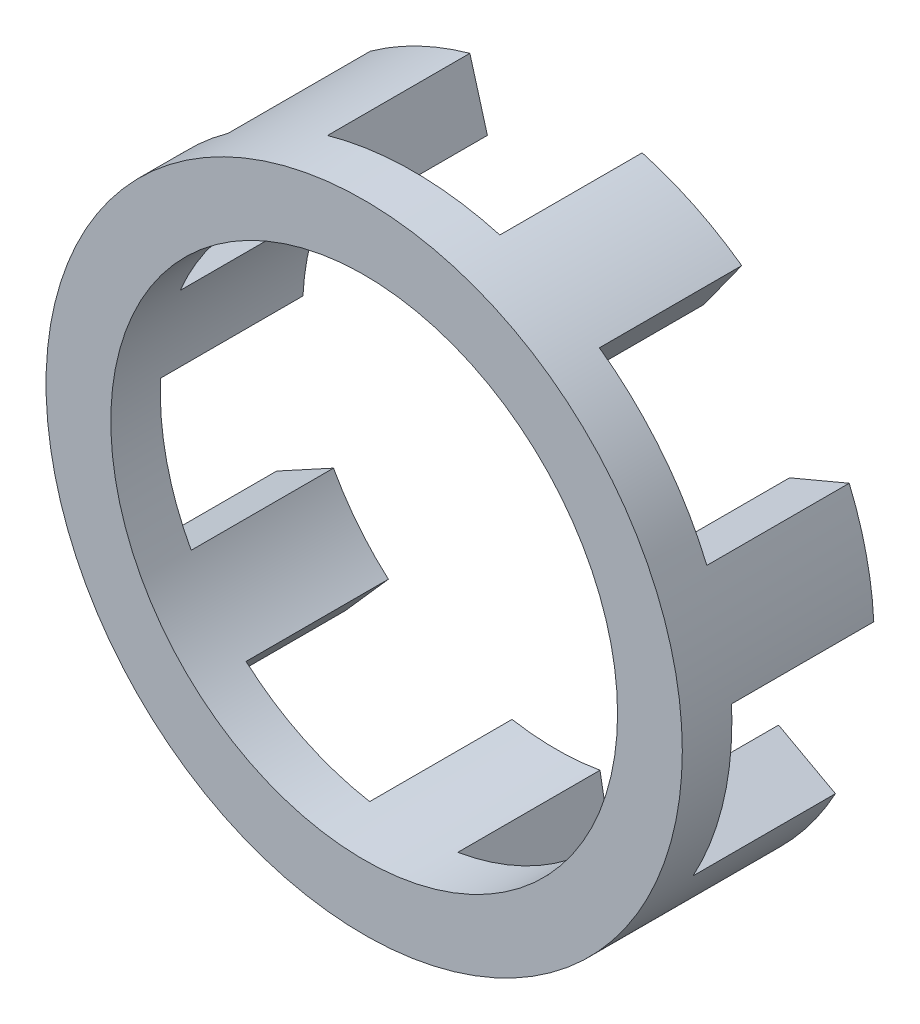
SolidWorks part; units mm, degrees
ref_plane "Front Plane" through (0, 0, 0) normal (0, 0, 1) x (1, 0, 0)
ref_plane "Top Plane" through (0, 0, 0) normal (0, 1, 0) x (1, 0, 0)
ref_plane "Right Plane" through (0, 0, 0) normal (1, 0, 0) x (0, 0, -1)
sketch "Sketch1" plane through (0, 0, 0) normal (0, 0, 1) x (1, 0, 0)
  circle A0 centre (-0.0364, -0.0594) radius 8.1608
  circle A1 centre (-0.0364, -0.0594) radius 6.4998
extrude "Boss-Extrude1" add sketch "Sketch1" against normal blind 1.27
sketch "Sketch2" plane through (0, 0, -1.27) normal (0, 0, -1) x (-1, 0, 0)
  line L0 (0.0364, -0.0594) -> (0.0364, -8.2202) construction
  line L1 (1.1651, -6.4605) -> (1.4535, -8.0962)
  line L2 (1.1651, -6.4605) -> (0.0364, -0.0594) construction
  line L3 (-1.0923, -6.4605) -> (-1.3807, -8.0962)
  line L4 (-1.0923, -6.4605) -> (0.0364, -0.0594) construction
  circle A0 centre (0.0364, -0.0594) radius 6.4998 construction
  arc A1 (-1.0923, -6.4605) -> (1.1651, -6.4605) centre (0.0364, -0.0594) ccw
  circle A2 centre (0.0364, -0.0594) radius 8.1608 construction
  arc A3 (-1.3807, -8.0962) -> (1.4535, -8.0962) centre (0.0364, -0.0594) ccw
  dimension "D1" = 10
  dimension "D2" = 10
extrude "Boss-Extrude2" add sketch "Sketch2" along normal blind 3.6513
pattern_circular "CirPattern1" count 7 over 360 about axis through (-0.0364, -0.0594, 0) along (0, 0, 1) of "Boss-Extrude2"
